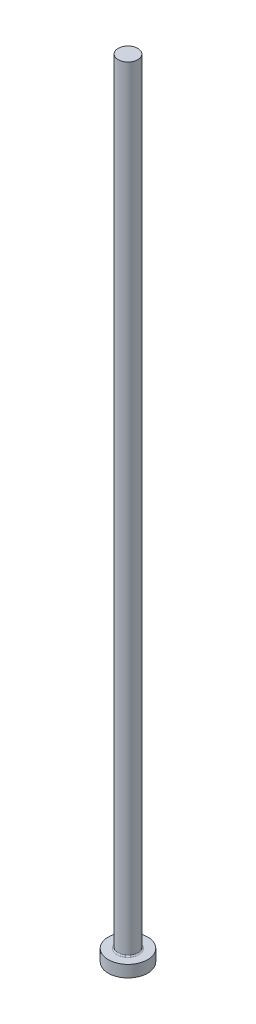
SolidWorks part; units mm, degrees
ref_plane "Plano frontal" through (0, 0, 0) normal (0, 0, 1) x (1, 0, 0)
ref_plane "Plano superior" through (0, 0, 0) normal (0, 1, 0) x (1, 0, 0)
ref_plane "Plano direito" through (0, 0, 0) normal (1, 0, 0) x (0, 0, -1)
sketch "Esboço1" plane through (0, 0, 0) normal (0, 0, 1) x (1, 0, 0)
  line L0 (0, 0) -> (5, 0)
  line L1 (5, 0) -> (5, 3)
  line L2 (5, 3) -> (2.8, 3)
  line L3 (2.5, 3.3) -> (2.5, 200)
  line L4 (2.5, 200) -> (0, 200)
  line L5 (0, 200) -> (0, 0) construction
  line L6 (0, 0) -> (0, 200)
  arc A0 (2.8, 3) -> (2.5, 3.3) centre (2.8, 3.3) cw
  dimension "D3" = 0.3
  dimension "D1" = 10
  dimension "D2" = 5
  dimension "D4" = 3
  dimension "D5" = 200
revolve "Revolução1" add sketch "Esboço1" angle 360 about L5
sketch "Esboço2"
  dimension "D1" = 0.375
  dimension "D2" = 0.875
  dimension "D3" = 0.5625
  dimension "D4" = 2.6875
wrap "Envolver1" sketch "Esboço2" source sketch "Esboço2" thickness 0.1 parameters "D1"=0.1
